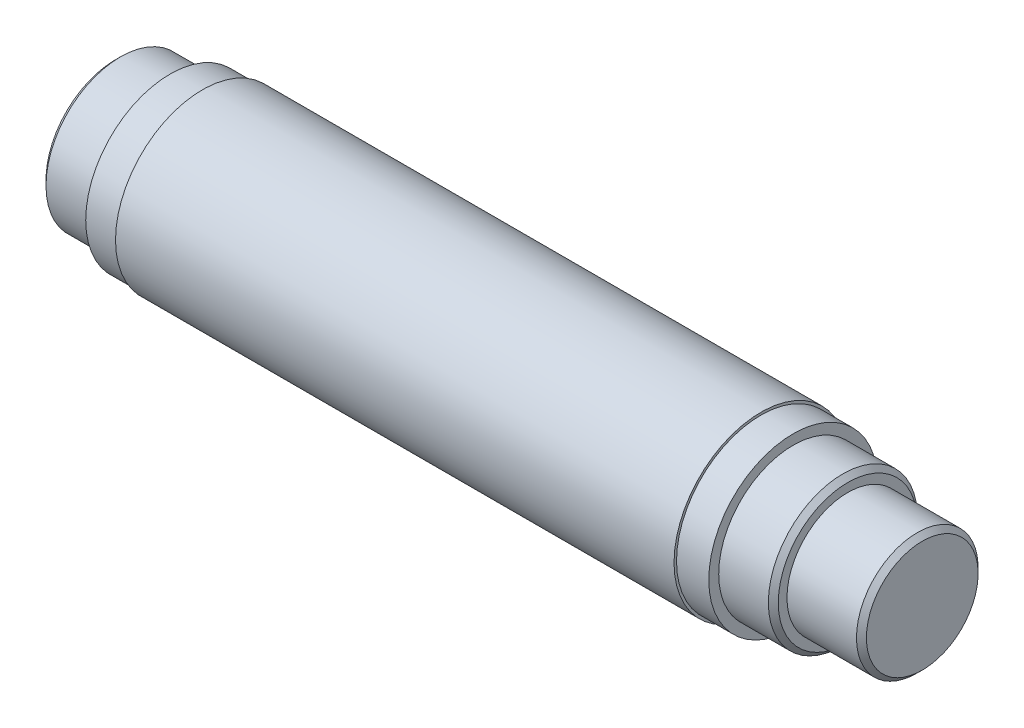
SolidWorks part; units mm, degrees
ref_plane "前视基准面" through (0, 0, 0) normal (0, 0, 1) x (1, 0, 0)
ref_plane "上视基准面" through (0, 0, 0) normal (0, 1, 0) x (1, 0, 0)
ref_plane "右视基准面" through (0, 0, 0) normal (1, 0, 0) x (0, 0, -1)
sketch "草图1" plane through (0, 0, 0) normal (0, 0, 1) x (1, 0, 0)
  line L0 (-63.6784, 0) -> (134.0278, 0) construction
  line L1 (0, 0) -> (0, 30)
  line L2 (0, 30) -> (22, 30)
  line L3 (22, 30) -> (22, 34)
  line L4 (22, 34) -> (35, 34)
  line L5 (35, 34) -> (35, 35)
  line L6 (35, 35) -> (260, 35)
  line L7 (260, 35) -> (260, 34)
  line L8 (260, 34) -> (273, 34)
  line L9 (273, 34) -> (273, 30)
  line L10 (273, 30) -> (295, 30)
  line L11 (295, 30) -> (295, 25)
  line L12 (295, 25) -> (305, 25)
  line L13 (305, 25) -> (305, 24.5)
  line L14 (305, 24.5) -> (325, 24.5)
  line L15 (325, 24.5) -> (325, 0)
  line L16 (325, 0) -> (0, 0)
  dimension "D1" = 35
  dimension "D2" = 34
  dimension "D3" = 30
  dimension "D4" = 34
  dimension "D5" = 30
  dimension "D6" = 25
  dimension "D7" = 24.5
  dimension "D8" = 22
  dimension "D9" = 13
  dimension "D10" = 13
  dimension "D11" = 10
  dimension "D12" = 20
  dimension "D13" = 22
  dimension "D14" = 225
revolve "旋转2" add sketch "草图1" angle 360 about L0
chamfer "倒角1" distance 2 angle 45 3 edges at (325, 0, 24.5) (0, 0, 30) (295, 0, 30)
sketch "草图2" plane through (305, 0, 0) normal (1, 0, 0) x (0, 0, -1)
  circle A0 centre (0, 0) radius 24.5 construction
  circle A1 centre (0, 0) radius 25
  circle A2 centre (0, 0) radius 25
  circle A3 centre (0, 0) radius 24.5
  dimension "D1" = 0
extrude "拉伸1" cut sketch "草图2" against normal up to surface (10 mm away)
